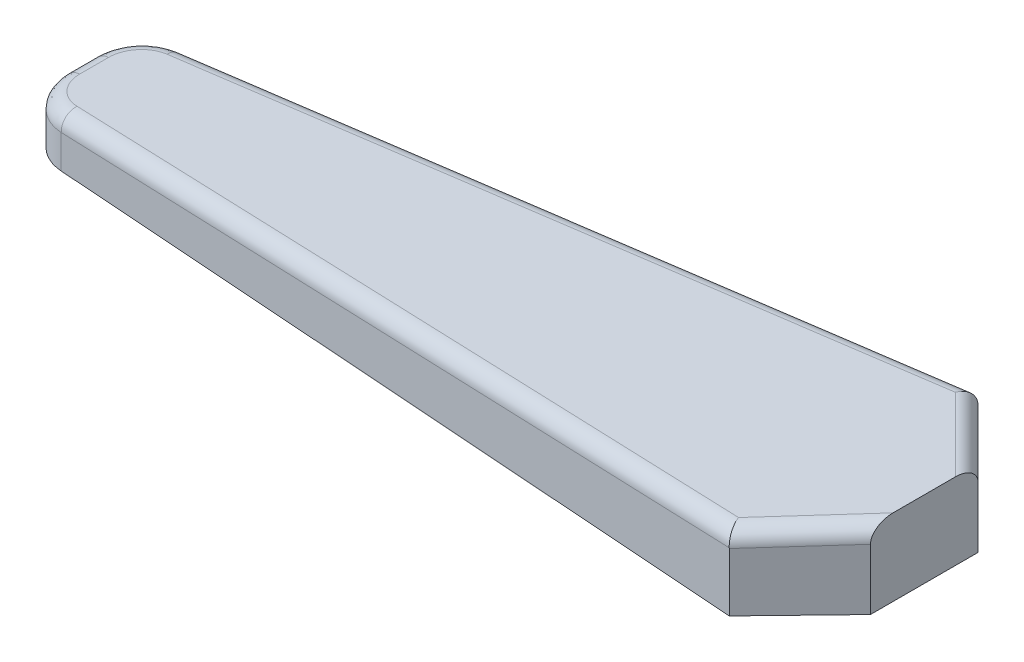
SolidWorks part; units mm, degrees
ref_plane "Front" through (0, 0, 0) normal (0, 0, 1) x (1, 0, 0)
ref_plane "Top" through (0, 0, 0) normal (0, 1, 0) x (1, 0, 0)
ref_plane "Right" through (0, 0, 0) normal (1, 0, 0) x (0, 0, -1)
sketch "Sketch2" plane through (0, 0, 0) normal (1, 0, 0) x (0, 0, -1)
  line L0 (-3.5, -2.5) -> (3.5, 2.5) construction
  line L1 (-3.5, -2.5) -> (3.5, -2.5)
  line L2 (-3.5, -2.5) -> (-3.5, 2.5)
  line L3 (-3.5, 2.5) -> (3.5, 2.5)
  line L4 (3.5, -2.5) -> (3.5, 2.5)
  dimension "D1" = 7
  dimension "D2" = 5
extrude "Extrude1" add sketch "Sketch2" against normal blind 5
draft "Draft1" type of draft neutral plane draft angle 45 faces to draft 2 parameters "D1"=45
sketch "Sketch3" plane through (-5, 0, 0) normal (-1, 0, 0) x (0, 0, 1)
  line L1 (-8.5, -2.5) -> (8.5, -2.5)
  line L2 (-8.5, -2.5) -> (-8.5, 2.5)
  line L3 (-8.5, 2.5) -> (8.5, 2.5)
  line L4 (8.5, -2.5) -> (8.5, 2.5)
extrude "Extrude2" add sketch "Sketch3" along normal blind 50
draft "Draft3" type of draft neutral plane draft angle 5 faces to draft 2 parameters "D1"=5
draft "Draft4" type of draft neutral plane draft angle 3 faces to draft 1 parameters "D1"=3
draft "Draft5" type of draft neutral plane draft angle 1 faces to draft 1 parameters "D1"=1
fillet "Fillet1" radius 3
fillet "Fillet2" radius 1
